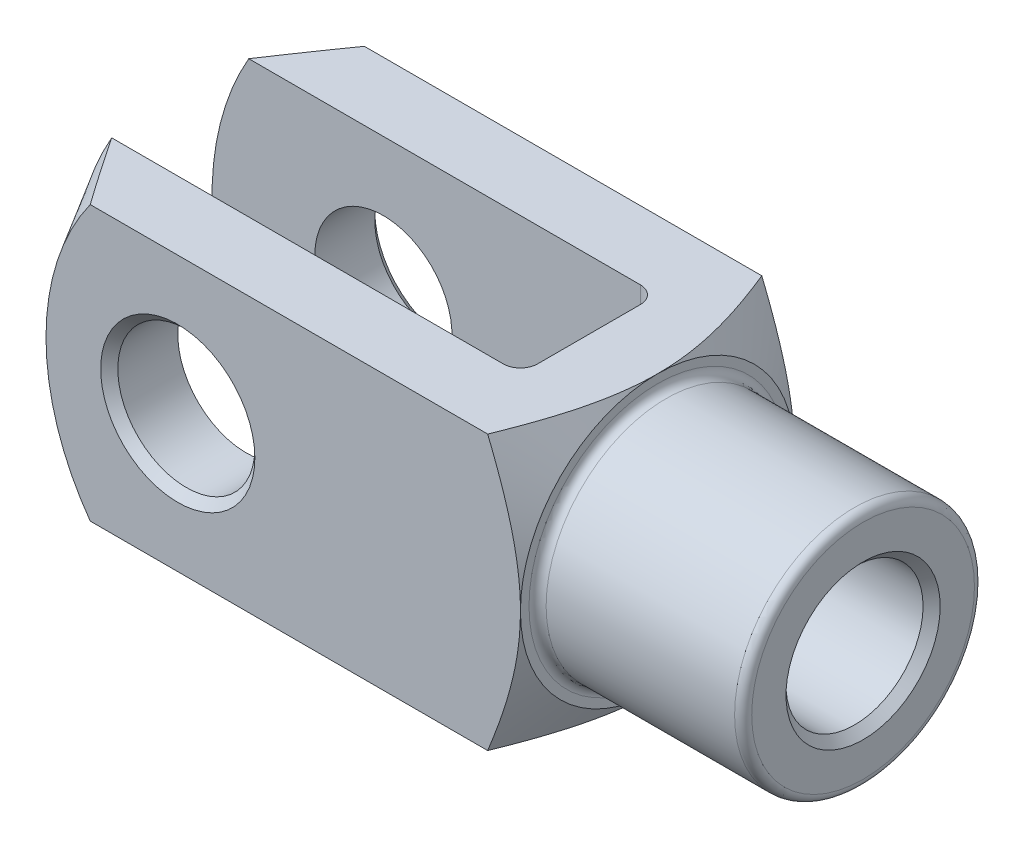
SolidWorks part; units mm, degrees
ref_plane "Front Plane" through (0, 0, 0) normal (0, 0, 1) x (1, 0, 0)
ref_plane "Top Plane" through (0, 0, 0) normal (0, 1, 0) x (1, 0, 0)
ref_plane "Right Plane" through (0, 0, 0) normal (1, 0, 0) x (0, 0, -1)
sketch "Sketch1" plane through (0, 0, 0) normal (1, 0, 0) x (0, 0, -1)
  line L0 (0, 0) -> (0, 50000) construction
  line L1 (0, 0) -> (50000, 0) construction
  line L2 (-8, -8) -> (-8, 8)
  line L3 (-8, 8) -> (8, 8)
  line L4 (8, -8) -> (8, 8)
  line L5 (-8, -8) -> (8, -8)
  point P9 (0, 8)
  point P11 (8, 0)
  point P12 (-8, 0)
  dimension "D1" = 16
  dimension "D2" = 16
extrude "Extrude1" add sketch "Sketch1" against normal blind 42
sketch "Sketch2" plane through (0, 0, 0) normal (1, 0, 0) x (0, 0, -1)
  circle A0 centre (0, 0) radius 7
  circle A1 centre (0, 0) radius 14
  dimension "D1" = 14
  dimension "D2" = 28
extrude "Extrude2" cut sketch "Sketch2" against normal blind 12
sketch "Sketch3" plane through (0, 0, 8) normal (0, 0, 1) x (1, 0, 0)
  circle A0 centre (-32, 0) radius 4
  dimension "D1" = 8
  dimension "D2" = 32
extrude "Extrude3" cut sketch "Sketch3" against normal through all
sketch "Sketch4" plane through (0, 8, 0) normal (0, 1, 0) x (1, 0, 0)
  line L0 (0, 0) -> (-50000, 0) construction
  line L1 (-42, -4) -> (-42, 4)
  line L2 (-42, 8) -> (-42, -8) construction
  line L3 (-42, 4) -> (-16, 4)
  line L4 (-16, 4) -> (-16, -4)
  line L5 (-32, 8) -> (-32, -8) construction
  line L6 (-42, -4) -> (-16, -4)
  point P7 (-32, 0)
  point P13 (-16, 0)
  point P14 (-42, 0)
  dimension "D1" = 16
  dimension "D2" = 8
extrude "Extrude4" cut sketch "Sketch4" against normal through all
fillet "Fillet1" radius 1 2 edges at (-16, 0, 4) (-16, 0, -4)
fillet "Fillet2" radius 0.5 2 edges at (0, 0, -7) (-12, 0, -7)
chamfer "Chamfer2" distance 0.5 angle 45 2 edges at (-28, 0, -8) (-28, 0, 8)
sketch "Sketch6" plane through (0, 0, 0) normal (0, 0, 1) x (1, 0, 0)
  line L0 (-12, -8) -> (-12, -16)
  line L1 (-12, -16) -> (-16.6188, -16)
  line L2 (-16.6188, -16) -> (-12, -8)
  dimension "D1" = 30
  dimension "D2" = 16
revolve "Cut-Revolve1" cut sketch "Sketch6" angle 360 about axis through (-12, 0, 0) along (1, 0, 0)
sketch "Sketch7" plane through (0, 0, 0) normal (0, 1, 0) x (1, 0, 0)
  line L0 (-39.6906, -8) -> (-42, -4)
  line L1 (-42, 4) -> (-39.6906, 8)
  line L2 (-39.6906, 8) -> (-58, 8)
  line L3 (-42, 4) -> (-42, -4)
  line L4 (-58, 8) -> (-58, -8)
  line L5 (-58, -8) -> (-39.6906, -8)
  line L6 (-42, 8) -> (-13.9132, 8) construction
  line L7 (-42, -8) -> (-13.9132, -8) construction
  line L8 (-26, 0.6162) -> (-26, 50000.6162) construction
  dimension "D1" = 120
  dimension "D2" = 16
  dimension "D3" = 16
revolve "Cut-Revolve2" cut sketch "Sketch7" angle 180 about L8
sketch "Sketch8" plane through (0, 0, 0) normal (1, 0, 0) x (0, 0, -1)
  circle A0 centre (0, 0) radius 4
  dimension "D1" = 8
extrude "Extrude5" cut sketch "Sketch8" against normal through all
chamfer "Chamfer3" distance 0.5 angle 45 1 edges at (0, 0, -4)
equation "\"D2@Sketch1\" = \"D1@Sketch1\""
equation "\"D2@Sketch2\" = \"D1@Sketch2\"*2"
equation "\"D2@Sketch6\" = \"D1@Sketch1\""
equation "\"D2@Sketch7\" = \"D1@Sketch1\""
equation "\"D3@Sketch7\" = \"D1@Sketch1\""
